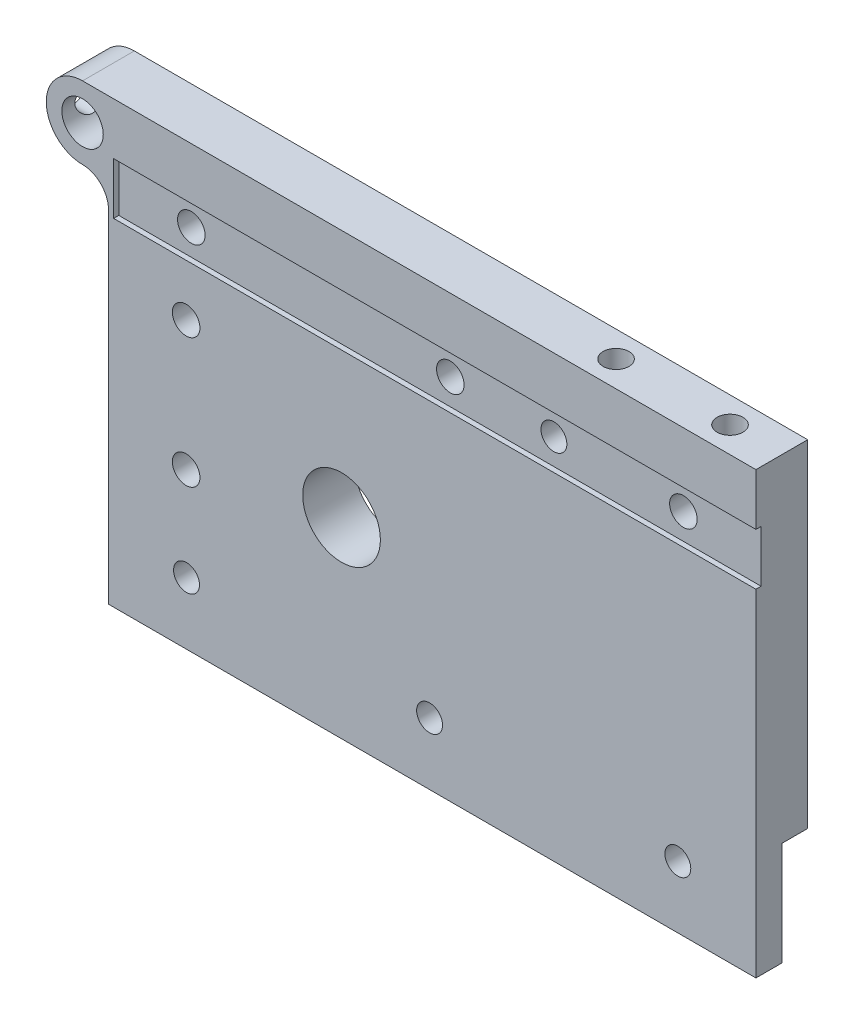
SolidWorks part; units mm, degrees
ref_plane "Front Plane" through (0, 0, 0) normal (0, 0, 1) x (1, 0, 0)
ref_plane "Top Plane" through (0, 0, 0) normal (0, 1, 0) x (1, 0, 0)
ref_plane "Right Plane" through (0, 0, 0) normal (1, 0, 0) x (0, 0, -1)
sketch "Sketch1" plane through (0, 0, 0) normal (0, 0, 1) x (1, 0, 0)
  line L0 (-743.1243, 0) -> (36413.0918, 0) construction
  line L1 (0, -743.1243) -> (0, 36413.0918) construction
  line L3 (-85.725, 53.975) -> (79.375, 53.975)
  line L4 (-79.375, 29.845) -> (-79.375, -53.975)
  line L5 (-79.375, -53.975) -> (79.375, -53.975)
  line L6 (79.375, 53.975) -> (79.375, -53.975)
  arc A0 (-85.725, 53.975) -> (-85.725, 36.195) centre (-85.725, 45.085) ccw
  circle A1 centre (-85.725, 45.085) radius 5.08
  arc A2 (-79.375, 29.845) -> (-85.725, 36.195) centre (-85.725, 29.845) ccw
  circle A3 centre (-22.225, -6.985) radius 9.525
  circle A4 centre (-60.2288, -38.735) radius 3.175
  circle A5 centre (-0.635, -38.735) radius 3.175
  circle A6 centre (60.2288, -38.735) radius 3.175
  dimension "D4" = 10.16
  dimension "D5" = 17.78
  dimension "D6" = 6.35
  dimension "D8" = 19.05
  dimension "D10" = 6.35
  dimension "D1" = 107.95
  dimension "D2" = 158.75
  dimension "D3" = 165.1
  dimension "D7" = 60.96
  dimension "D9" = 101.6
  dimension "D11" = 139.6038
  dimension "D12" = 15.24
  dimension "D13" = 78.74
extrude "Boss-Extrude1" add sketch "Sketch1" along normal mid plane 12.7
sketch "Sketch2" plane through (0, 0, 0) normal (0, 0, 1) x (1, 0, 0)
  line L0 (79.375, -53.975) -> (79.375, 53.975) construction
  line L1 (-79.375, -53.975) -> (79.375, -53.975)
  line L2 (-79.375, -53.975) -> (-79.375, -28.575)
  line L3 (-79.375, -28.575) -> (79.375, -28.575)
  line L4 (79.375, -53.975) -> (79.375, -28.575)
  dimension "D1" = 25.4
extrude "Cut-Extrude1" cut sketch "Sketch2" against normal blind 12.7
sketch "Sketch3" plane through (0, 0, 6.35) normal (0, 0, 1) x (1, 0, 0)
  line L0 (79.375, 53.975) -> (-85.725, 53.975) construction
  line L1 (79.375, -53.975) -> (79.375, 53.975) construction
  point P0 (-60.325, 34.925)
  point P1 (-60.325, 15.875)
  point P2 (-60.325, -15.875)
  point P3 (28.575, 34.925)
  point P4 (3.175, 34.925)
  point P5 (60.325, 34.925)
  dimension "D1" = 19.05
  dimension "D2" = 38.1
  dimension "D3" = 69.85
  dimension "D4" = 31.75
  dimension "D5" = 76.2
  dimension "D6" = 50.8
  dimension "D7" = 139.7
sketch "Sketch6" plane through (0, 0, 6.35) normal (0, 0, 1) x (1, 0, 0)
  circle A0 centre (28.575, 34.925) radius 3.175
  dimension "D1" = 6.35
extrude "Cut-Extrude2" cut sketch "Sketch6" against normal blind 22.098
sketch "Sketch7" plane through (0, 0, -6.35) normal (0, 0, -1) x (-1, 0, 0)
  line L0 (-79.375, -28.575) -> (-79.375, 53.975) construction
  line L1 (-79.375, 41.275) -> (76.073, 41.275)
  line L2 (-79.375, 41.275) -> (-79.375, 28.575)
  line L3 (-79.375, 28.575) -> (76.073, 28.575)
  line L4 (79.375, 37.973) -> (79.375, 31.877)
  line L5 (-1003.175, 34.925) -> (48996.825, 34.925) construction
  arc A0 (76.073, 28.575) -> (79.375, 31.877) centre (76.073, 31.877) ccw
  arc A1 (76.073, 41.275) -> (79.375, 37.973) centre (76.073, 37.973) cw
  point P13 (79.375, 41.275)
  dimension "D3" = 3.302
  dimension "D1" = 158.75
  dimension "D2" = 12.7
sketch "Sketch8" plane through (0, 53.975, 0) normal (0, 1, 0) x (1, 0, 0)
  line L0 (79.375, -6.35) -> (79.375, 6.35) construction
  circle A0 centre (66.675, 0) radius 3.175
  circle A1 centre (38.735, 0) radius 3.175
  point P6 (79.375, 0)
  dimension "D1" = 6.35
  dimension "D2" = 12.7
  dimension "D3" = 40.64
extrude "Cut-Extrude4" cut sketch "Sketch8" against normal blind 12.7
ref_plane "Plane1" through (-94.615, 0, 0) normal (-1, 0, 0) x (0, 0, 1)
sketch "Sketch9" plane through (-94.615, 0, 0) normal (-1, 0, 0) x (0, 0, 1)
  line L0 (6.35, 53.975) -> (-6.35, 53.975) construction
  circle A0 centre (0, 45.085) radius 3.175
  dimension "D1" = 6.35
  dimension "D2" = 8.89
extrude "Cut-Extrude5" cut sketch "Sketch9" against normal blind 8.89
sketch "Sketch10" plane through (0, 0, -6.35) normal (0, 0, -1) x (-1, 0, 0)
  point P0 (-60.325, 34.925)
  point P1 (-3.175, 34.925)
  point P3 (60.325, 34.925)
  point P5 (60.325, 15.875)
  point P7 (60.325, -15.875)
hole_wizard "CBORE for 1/4 Pan Head Machine Screw1" positions "Sketch11" profile "Sketch12" counterbore size "1/4" standard "ANSI Inch"
sketch "Sketch11" plane through (0, 0, -6.35) normal (0, 0, -1) x (-1, 0, 0)
  point P0 (-60.325, 34.925)
  point P3 (-3.175, 34.925)
  point P6 (60.325, 34.925)
  point P9 (60.325, 15.875)
  point P12 (60.325, -15.875)
sketch "Sketch12" plane through (60.325, 34.925, -6.35) normal (1, 0, 0) x (0, 1, 0)
  line L0 (0, 0) -> (0, 12.7)
  line L1 (0, 12.7) -> (3.3782, 12.7)
  line L3 (3.3782, 12.7) -> (3.3782, 6.35)
  line L4 (3.3782, 6.35) -> (5.2324, 6.35)
  line L5 (5.2324, 6.35) -> (5.2324, 0)
  line L7 (5.2324, 0) -> (0, 0)
  line L11 (0, -6.35) -> (0, 107.95) construction
  dimension "Thru Hole Dia." = 6.7564
  dimension "Thru Hole Depth" = 12.7
  dimension "C'Bore Dia." = 10.4648
  dimension "C'Bore Depth" = 6.35
sketch "Sketch13" plane through (0, 0, 6.35) normal (0, 0, 1) x (1, 0, 0)
  line L0 (79.375, 41.275) -> (-78.105, 41.275)
  line L1 (-78.105, 41.275) -> (-78.105, 28.575)
  line L2 (-79.375, 29.845) -> (-79.375, -53.975) construction
  line L3 (-78.105, 28.575) -> (79.375, 28.575)
  line L4 (79.375, 28.575) -> (79.375, 41.275)
  point P11 (-79.375, 28.575)
  point P14 (-79.375, 41.275)
  dimension "D1" = 157.48
extrude "Cut-Extrude6" cut sketch "Sketch13" against normal blind 1.27
